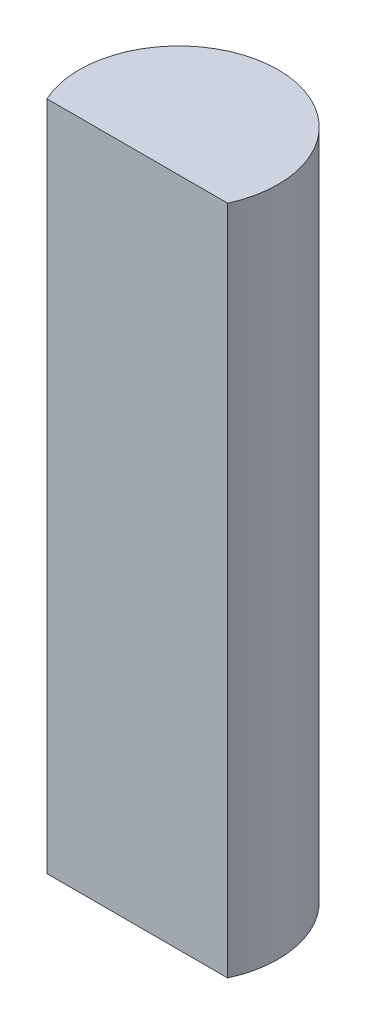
SolidWorks part; units mm, degrees
ref_plane "Front Plane" through (0, 0, 0) normal (0, 0, 1) x (1, 0, 0)
ref_plane "Top Plane" through (0, 0, 0) normal (0, 1, 0) x (1, 0, 0)
ref_plane "Right Plane" through (0, 0, 0) normal (1, 0, 0) x (0, 0, -1)
sketch "Sketch1" plane through (0, 0, 0) normal (0, 1, 0) x (1, 0, 0)
  line L0 (-5.4544, -2.5) -> (5.624, -2.5) construction
  line L1 (0, 6) -> (6, 6) construction
  line L2 (-5.4544, -2.5) -> (5.4544, -2.5)
  arc A0 (-5.4544, -2.5) -> (5.4544, -2.5) centre (0, 0) cw
  dimension "D1" = 6
  dimension "D2" = 8.5
extrude "Boss-Extrude1" add sketch "Sketch1" along normal blind 40.5
